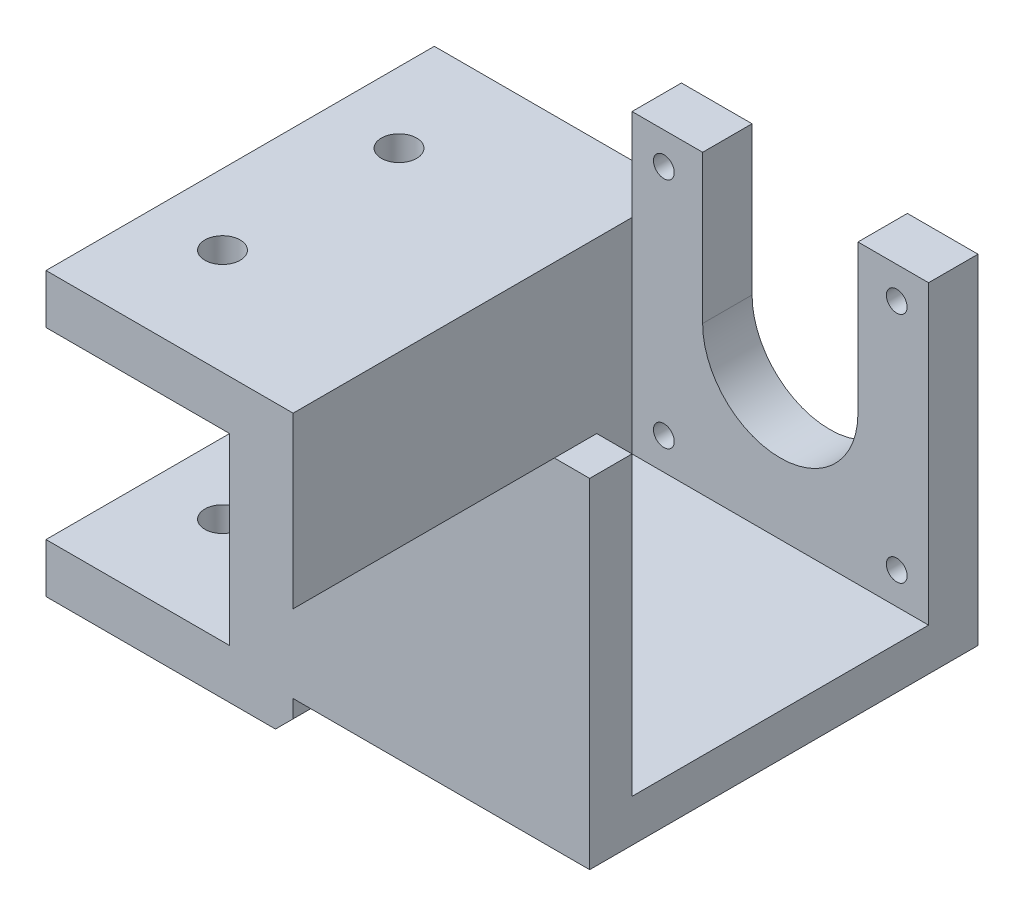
SolidWorks part; units mm, degrees
ref_plane "Alzado" through (0, 0, 0) normal (0, 0, 1) x (1, 0, 0)
ref_plane "Planta" through (0, 0, 0) normal (0, 1, 0) x (1, 0, 0)
ref_plane "Vista lateral" through (0, 0, 0) normal (1, 0, 0) x (0, 0, -1)
sketch "Sketch1" plane through (0, 0, 0) normal (0, 0, 1) x (1, 0, 0)
  line L0 (-11, 0) -> (-11, 21)
  line L1 (-21, 21) -> (-11, 21)
  line L2 (-21, 21) -> (-21, -21)
  line L4 (21, 21) -> (21, -21)
  line L5 (-21, 21) -> (21, -21) construction
  line L6 (-21, -21) -> (21, 21) construction
  line L7 (11, 0) -> (11, 21)
  line L8 (11, 21) -> (21, 21)
  line L9 (-21, -27) -> (21, -27)
  line L10 (-21, -21) -> (-21, -27)
  line L11 (21, -21) -> (21, -27)
  circle A0 centre (-16.49, 16.49) radius 1.47
  circle A1 centre (16.49, -16.49) radius 1.47
  circle A2 centre (16.49, 16.49) radius 1.47
  circle A3 centre (-16.49, -16.49) radius 1.47
  arc A4 (-11, 0) -> (11, 0) centre (0, 0) ccw
  point P0 (0, 0)
  dimension "D3" = 2.94
  dimension "D4" = 4.51
  dimension "D6" = 2.94
  dimension "D9" = 22
  dimension "D1" = 42
  dimension "D2" = 42
  dimension "D5" = 4.51
  dimension "D7" = 4.51
  dimension "D8" = 4.51
  dimension "D10" = 6
extrude "Boss-Extrude2" add sketch "Sketch1" along normal blind 55
sketch "Sketch2" plane through (0, 21, 0) normal (0, 1, 0) x (1, 0, 0)
  line L0 (-21, -55) -> (-21, 0) construction
  line L1 (-21, -7) -> (21, -7)
  line L2 (-21, -7) -> (-21, -49)
  line L3 (-21, -49) -> (21, -49)
  line L4 (21, -7) -> (21, -49)
  line L5 (-21, -7) -> (21, -49) construction
  line L6 (-21, -49) -> (21, -7) construction
  line L7 (-11, -55) -> (-21, -55) construction
  point P0 (0, -28)
  dimension "D1" = 42
  dimension "D2" = 42
  dimension "D3" = 6
extrude "Cut-Extrude1" cut sketch "Sketch2" against normal blind 42
sketch "Sketch4" plane through (-21, 0, 0) normal (-1, 0, 0) x (0, 0, 1)
  line L0 (55, 21) -> (55, -27) construction
  line L1 (49, 21) -> (55, 21)
  line L2 (49, 21) -> (49, -21)
  line L3 (49, -21) -> (55, -21)
  line L4 (55, 21) -> (55, -21)
  line L5 (7, -21) -> (49, -21) construction
extrude "Cut-Extrude2" cut sketch "Sketch4" against normal blind 42
sketch "Sketch5" plane through (0, 0, 55) normal (0, 0, 1) x (1, 0, 0)
  line L0 (-21, -21) -> (21, -21)
  line L1 (21, -21) -> (21, 21)
  line L3 (21, 21) -> (16, 21)
  line L4 (21, 21) -> (11, 21) construction
  line L5 (16, 21) -> (-21, -16)
  line L6 (-21, -21) -> (-21, 21) construction
  line L7 (-21, -16) -> (-21, -21)
  dimension "D1" = 5
  dimension "D2" = 5
extrude "Boss-Extrude3" add sketch "Sketch5" against normal blind 6
sketch "Sketch7" plane through (0, 0, 0) normal (0, 0, -1) x (-1, 0, 0)
  line L0 (21, 8) -> (21, -32)
  line L1 (21, 21) -> (21, -27) construction
  line L2 (21, -32) -> (56, -32)
  line L3 (56, -32) -> (56, 8)
  line L4 (21, 8) -> (56, 8)
  line L5 (21, -27) -> (-21, -27) construction
  line L7 (56, 1) -> (30, 1)
  line L8 (56, 1) -> (56, -25)
  line L9 (56, -25) -> (30, -25)
  line L10 (30, 1) -> (30, -25)
  dimension "D1" = 40
  dimension "D2" = 5
  dimension "D3" = 35
  dimension "D4" = 26
  dimension "D5" = 26
  dimension "D6" = 7
extrude "Boss-Extrude4" add sketch "Sketch7" against normal blind 55 contours L10 L7 L3 L4 L0 L2 L9 M9
sketch "Sketch8" plane through (0, -32, 0) normal (0, -1, 0) x (1, 0, 0)
  line L0 (-56, 55) -> (-56, 0) construction
  line L1 (-21, 55) -> (-56, 55) construction
  line L2 (-21, 0) -> (-56, 0) construction
  circle A0 centre (-46, 40) radius 2.5
  circle A1 centre (-46, 15) radius 2.5
  dimension "D1" = 5
  dimension "D4" = 5
  dimension "D2" = 10
  dimension "D3" = 15
  dimension "D5" = 15
extrude "Cut-Extrude3" cut sketch "Sketch8" against normal blind 55
sketch "Sketch9" plane through (0, 0, 0) normal (0, 0, -1) x (-1, 0, 0)
  line L0 (23.5, -32) -> (21, -32)
  line L1 (21, -32) -> (56, -32) construction
  line L2 (21, -32) -> (21, -29.5)
  line L3 (21, -32) -> (21, -27) construction
  line L4 (21, -29.5) -> (23.5, -32)
  dimension "D1" = 2.5
extrude "Cut-Extrude4" cut sketch "Sketch9" against normal blind 55
